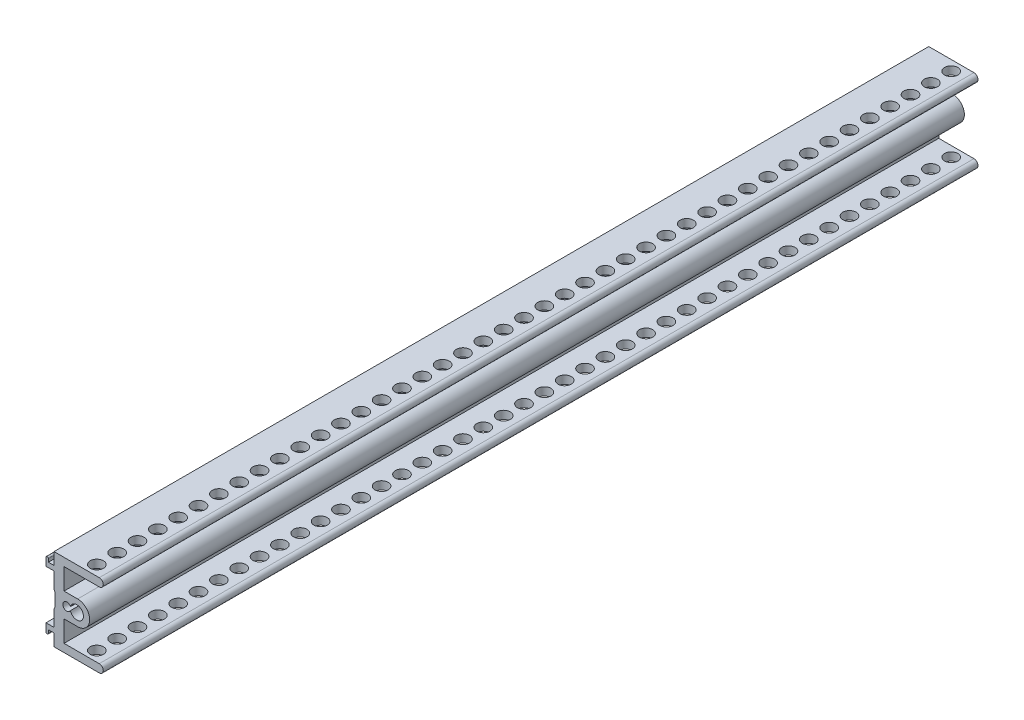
SolidWorks part; units mm, degrees
ref_plane "前视基准面" through (0, 0, 0) normal (0, 0, 1) x (1, 0, 0)
ref_plane "上视基准面" through (0, 0, 0) normal (0, 1, 0) x (1, 0, 0)
ref_plane "右视基准面" through (0, 0, 0) normal (1, 0, 0) x (0, 0, -1)
sketch "草图1" plane through (0, 0, 0) normal (0, 0, 1) x (1, 0, 0)
  line L0 (-4.15, 8.3) -> (-4.15, 3)
  line L1 (-6.65, 10.3) -> (4.65, 10.3)
  line L2 (-6.65, 7.3) -> (-8.05, 7.3)
  line L3 (4.65, 8.3) -> (-4.15, 8.3)
  line L4 (-6.65, -6.1) -> (-6.65, -2.0884)
  line L5 (-6.65, 2.1116) -> (-6.35, 1.5116)
  line L6 (-0.75, 0) -> (3.3598, 0) construction
  line L7 (-6.65, -7.3) -> (-6.65, -10.3)
  line L8 (-8.65, -8.0782) -> (-8.65, -6.1)
  line L9 (-6.65, -6.1) -> (-8.65, -6.1)
  line L10 (-8.05, -8.0782) -> (-8.05, -7.3)
  line L11 (-6.65, -2.0884) -> (-6.35, -1.4884)
  line L12 (-6.65, 2.1116) -> (-6.65, 6.1)
  line L13 (4.65, -8.3) -> (-4.15, -8.3)
  line L14 (-6.65, -10.3) -> (4.65, -10.3)
  line L15 (-4.15, -8.3) -> (-4.15, -3)
  line L16 (-6.35, 1.5116) -> (-6.35, -1.4884)
  line L17 (-4.15, 3) -> (-0.75, 3)
  line L18 (-8.05, 8.0782) -> (-8.05, 7.3)
  line L19 (-0.75, -3) -> (-4.15, -3)
  line L20 (-6.65, 6.1) -> (-8.65, 6.1)
  line L21 (-8.65, 8.0782) -> (-8.65, 6.1)
  line L22 (-6.65, -7.3) -> (-8.05, -7.3)
  line L23 (-8.35, -8.3782) -> (-9.7583, -8.3782) construction
  line L24 (-8.35, 8.3782) -> (-9.5309, 8.3782) construction
  line L25 (-6.65, 7.3) -> (-6.65, 10.3)
  arc A0 (-8.65, 8.0782) -> (-8.05, 8.0782) centre (-8.35, 8.0782) cw
  arc A4 (4.65, -8.3) -> (4.65, -10.3) centre (4.65, -9.3) cw
  arc A6 (-8.65, -8.0782) -> (-8.05, -8.0782) centre (-8.35, -8.0782) ccw
  arc A8 (4.65, 8.3) -> (4.65, 10.3) centre (4.65, 9.3) ccw
  arc A10 (-0.75, 3) -> (-0.75, -3) centre (-0.75, 0) cw
  arc A11 (-2.5445, -0.4243) -> (-2.5445, 0.4243) centre (-0.95, 0) ccw
  arc A12 (-2.5445, 0.4243) -> (-2.5445, -0.4243) centre (-3.45, 0) ccw
  dimension "D4" = 1.4
  dimension "D12" = 16.7565
  dimension "D3" = 0.3
  dimension "D8" = 7.7
  dimension "D5" = 2
  dimension "D6" = 0.3
  dimension "D7" = 2
  dimension "D11" = 1
  dimension "D1" = 1.2
  dimension "D2" = 3
  dimension "D9" = 13.3
  dimension "D10" = 13.3
extrude "凸台-拉伸1" add sketch "草图1" along normal mid plane 218.44
sketch "草图3" plane through (0, -10.3, 0) normal (0, -1, 0) x (1, 0, 0)
  line L0 (-6.65, 109.22) -> (4.65, 109.22) construction
  line L2 (4.65, 109.22) -> (4.65, -109.22) construction
  circle A0 centre (1.5, 106.68) radius 1.65
  circle A1 centre (1.5, 101.6) radius 1.65
  circle A2 centre (1.5, 96.52) radius 1.65
  circle A3 centre (1.5, 91.44) radius 1.65
  circle A4 centre (1.5, 86.36) radius 1.65
  circle A5 centre (1.5, 81.28) radius 1.65
  circle A6 centre (1.5, 76.2) radius 1.65
  circle A7 centre (1.5, 71.12) radius 1.65
  circle A8 centre (1.5, 66.04) radius 1.65
  circle A9 centre (1.5, 60.96) radius 1.65
  circle A10 centre (1.5, 55.88) radius 1.65
  circle A11 centre (1.5, 50.8) radius 1.65
  circle A12 centre (1.5, 45.72) radius 1.65
  circle A13 centre (1.5, 40.64) radius 1.65
  circle A14 centre (1.5, 35.56) radius 1.65
  circle A15 centre (1.5, 30.48) radius 1.65
  circle A16 centre (1.5, 25.4) radius 1.65
  circle A17 centre (1.5, 20.32) radius 1.65
  circle A18 centre (1.5, 15.24) radius 1.65
  circle A19 centre (1.5, 10.16) radius 1.65
  circle A20 centre (1.5, 5.08) radius 1.65
  circle A21 centre (1.5, 0) radius 1.65
  circle A22 centre (1.5, -5.08) radius 1.65
  circle A23 centre (1.5, -10.16) radius 1.65
  circle A24 centre (1.5, -15.24) radius 1.65
  circle A25 centre (1.5, -20.32) radius 1.65
  circle A26 centre (1.5, -25.4) radius 1.65
  circle A27 centre (1.5, -30.48) radius 1.65
  circle A28 centre (1.5, -35.56) radius 1.65
  circle A29 centre (1.5, -40.64) radius 1.65
  circle A30 centre (1.5, -45.72) radius 1.65
  circle A31 centre (1.5, -50.8) radius 1.65
  circle A32 centre (1.5, -55.88) radius 1.65
  circle A33 centre (1.5, -60.96) radius 1.65
  circle A34 centre (1.5, -66.04) radius 1.65
  circle A35 centre (1.5, -71.12) radius 1.65
  circle A36 centre (1.5, -76.2) radius 1.65
  circle A37 centre (1.5, -81.28) radius 1.65
  circle A38 centre (1.5, -86.36) radius 1.65
  circle A39 centre (1.5, -91.44) radius 1.65
  circle A40 centre (1.5, -96.52) radius 1.65
  circle A41 centre (1.5, -101.6) radius 1.65
  circle A42 centre (1.5, -106.68) radius 1.65
  circle A43 centre (1.5, -111.76) radius 1.65
  circle A44 centre (1.5, -116.84) radius 1.65
  circle A45 centre (1.5, -121.92) radius 1.65
  circle A46 centre (1.5, -127) radius 1.65
  circle A47 centre (1.5, -132.08) radius 1.65
  circle A48 centre (1.5, -137.16) radius 1.65
  circle A49 centre (1.5, -142.24) radius 1.65
  circle A50 centre (1.5, -147.32) radius 1.65
  circle A51 centre (1.5, -152.4) radius 1.65
  circle A52 centre (1.5, -157.48) radius 1.65
  circle A53 centre (1.5, -162.56) radius 1.65
  circle A54 centre (1.5, -167.64) radius 1.65
  circle A55 centre (1.5, -172.72) radius 1.65
  circle A56 centre (1.5, -177.8) radius 1.65
  circle A57 centre (1.5, -182.88) radius 1.65
  circle A58 centre (1.5, -187.96) radius 1.65
  circle A59 centre (1.5, -193.04) radius 1.65
  circle A60 centre (1.5, -198.12) radius 1.65
  circle A61 centre (1.5, -203.2) radius 1.65
  circle A62 centre (1.5, -208.28) radius 1.65
  circle A63 centre (1.5, -213.36) radius 1.65
  circle A64 centre (1.5, -218.44) radius 1.65
  circle A65 centre (1.5, -223.52) radius 1.65
  circle A66 centre (1.5, -228.6) radius 1.65
  circle A67 centre (1.5, -233.68) radius 1.65
  circle A68 centre (1.5, -238.76) radius 1.65
  circle A69 centre (1.5, -243.84) radius 1.65
  circle A70 centre (1.5, -248.92) radius 1.65
  circle A71 centre (1.5, -254) radius 1.65
  circle A72 centre (1.5, -259.08) radius 1.65
  circle A73 centre (1.5, -264.16) radius 1.65
  circle A74 centre (1.5, -269.24) radius 1.65
  circle A75 centre (1.5, -274.32) radius 1.65
  circle A76 centre (1.5, -279.4) radius 1.65
  circle A77 centre (1.5, -284.48) radius 1.65
  circle A78 centre (1.5, -289.56) radius 1.65
  circle A79 centre (1.5, -294.64) radius 1.65
  circle A80 centre (1.5, -299.72) radius 1.65
  circle A81 centre (1.5, -304.8) radius 1.65
  circle A82 centre (1.5, -309.88) radius 1.65
  circle A83 centre (1.5, -314.96) radius 1.65
  circle A84 centre (1.5, -320.04) radius 1.65
  dimension "D1" = 3.3
  dimension "D2" = 3.15
  dimension "D4" = 85
  dimension "D3" = 2.54
extrude "切除-拉伸1" cut sketch "草图3" against normal blind 2.5
mirror "镜向1" about plane through (0, 0, 0) normal (0, 1, 0) of "切除-拉伸1"
